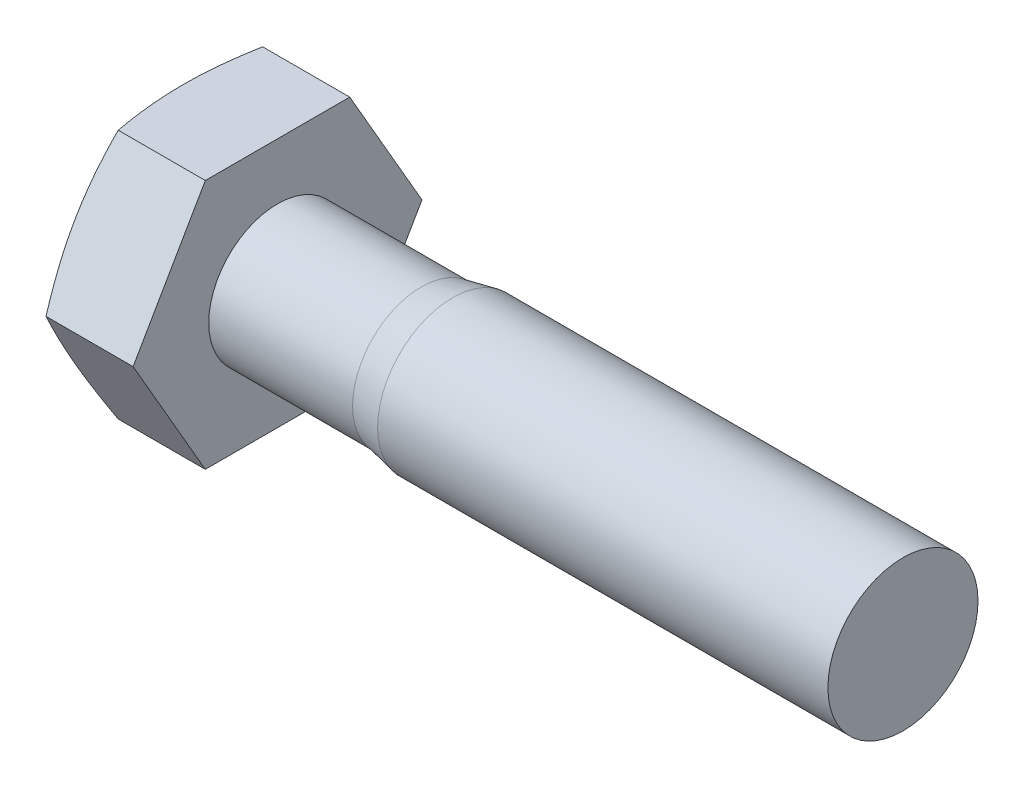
SolidWorks part; units mm, degrees
ref_plane "Front" through (0, 0, 0) normal (0, 0, 1) x (1, 0, 0)
ref_plane "Top" through (0, 0, 0) normal (0, 1, 0) x (1, 0, 0)
ref_plane "Right" through (0, 0, 0) normal (1, 0, 0) x (0, 0, -1)
sketch "Sketch1" plane through (0, 0, 0) normal (1, 0, 0) x (0, 0, -1)
  line L1 (5.7735, 0) -> (2.8868, 5)
  line L2 (2.8868, 5) -> (-2.8868, 5)
  line L3 (-2.8868, 5) -> (-5.7735, 0)
  line L4 (-5.7735, 0) -> (-2.8868, -5)
  line L5 (-2.8868, -5) -> (2.8868, -5)
  line L6 (2.8868, -5) -> (5.7735, 0)
  circle A0 centre (0, 0) radius 5 construction
  dimension "s" = 10
extrude "BaseHead" add sketch "Sketch1" along normal blind 4
ref_plane "Plane1" through (11, 0, 0) normal (1, 0, 0) x (0, 0, -1)
sketch "Sketch2" plane through (4, 0, 0) normal (1, 0, 0) x (0, 0, -1)
  circle A0 centre (0, 0) radius 3
  dimension "d" = 6
extrude "BaseBody" add sketch "Sketch2" along normal blind 25
sketch "Sketch3" plane through (3.1612, 0, 2.6123) normal (0, 1, 0) x (0, 0, -1)
  line L0 (2.6123, 5.2326) -> (2.6123, 1.6388) construction
  line L2 (8.3858, 3.1612) -> (8.3858, 2.6431)
  line L3 (8.3858, 2.6431) -> (6.9623, 3.1612)
  line L5 (6.9623, 3.1612) -> (8.3858, 3.1612)
  dimension "D1" = 20
  dimension "dw" = 8.7
revolve "HeadChamfer" cut sketch "Sketch3" angle 360 about L0
sketch "Sketch4" plane through (0, 0, 0) normal (-1, 0, 0) x (0, 0, 1)
  circle A0 centre (0, 0) radius 3.4
  dimension "da" = 6.8
extrude "Cut-Extrude1" cut sketch "Sketch4" against normal blind 0.8
sketch "Sketch5" plane through (-2.6796, 0, 8.1796) normal (0, 1, 0) x (0, 0, -1)
  line L0 (8.1796, 0.0175) -> (8.1796, -16.2361) construction
  line L2 (11.1796, -13.6796) -> (10.9296, -12.4296)
  line L4 (10.9296, -12.4296) -> (10.9296, -6.6796)
  line L6 (10.9296, -6.6796) -> (13.6796, -6.6796)
  line L7 (13.6796, -6.6796) -> (13.6796, -13.6796)
  line L8 (13.6796, -13.6796) -> (11.1796, -13.6796)
  line L11 (8.1796, -31.6796) -> (8.1796, -6.6796) construction
  line L14 (11.0664, -6.6796) -> (5.2929, -6.6796) construction
  line L16 (5.1796, -31.6796) -> (11.1796, -31.6796) construction
  line L17 (11.1796, -31.6796) -> (11.1796, -6.6796) construction
  dimension "ds" = 5.5
  dimension "x" = 1.25
  dimension "D3" = 18
  dimension "D4" = 11
revolve "Cut-Revolve1" cut sketch "Sketch5" angle 360 about L0
fillet "HeadFillet" [suppressed] radius 0.25
sketch "Sketch6" plane through (0, 0, 0) normal (0, 1, 0) x (1, 0, 0)
  line L0 (28.7293, 3.5415) -> (29.2708, 3.5415)
  line L1 (29.2708, 3.5415) -> (29.2708, 3)
  line L2 (29.2708, 3) -> (29, 2.531)
  line L3 (29, 2.531) -> (28.7293, 3)
  line L4 (28.7293, 3) -> (28.7293, 3.5415)
  line L5 (29, -3) -> (29, 3) construction
  line L6 (29, 3) -> (11, 3) construction
  dimension "D1" = 0.5415
revolve "Cut-Revolve10" [suppressed] cut sketch "Sketch6" angle 360
pattern_linear "LPattern10" [suppressed] count 28
equation "\"D1@Cut-Extrude1\" = 0.2 * \"k@BaseHead\""
equation "\"b@ThreadCosmetic1\" = \"l@BaseBody\" - \"lg@Plane1\""
equation "\"D4@Sketch5\" = 2 * \"ds@Sketch5\""
equation "\"D3@Sketch5\" = \"l@BaseBody\" - \"lg@Plane1\""
equation "\"D1@Sketch6\" =  ( \"d@Sketch2\" - \"D2@ThreadCosmetic1\" )  / 2"
equation "\"pitch@LPattern10\" = 1.2 * \"D1@Sketch6\""
equation "\"D1@LPattern10\" = \"b@ThreadCosmetic1\" / \"pitch@LPattern10\""
